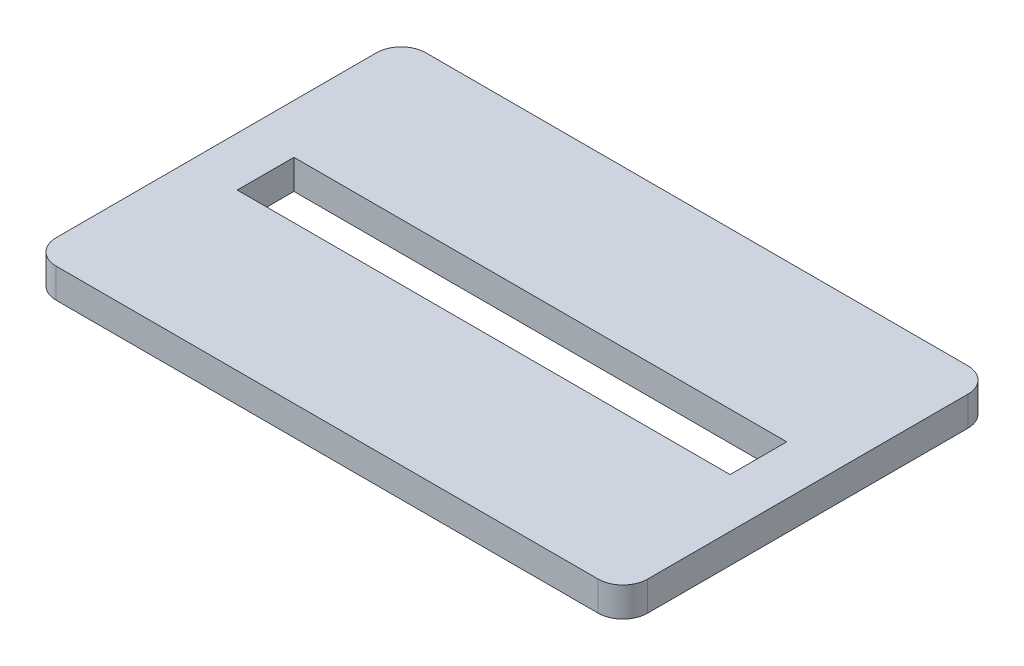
SolidWorks part; units mm, degrees
ref_plane "Front Plane" through (0, 0, 0) normal (0, 0, 1) x (1, 0, 0)
ref_plane "Top Plane" through (0, 0, 0) normal (0, 1, 0) x (1, 0, 0)
ref_plane "Right Plane" through (0, 0, 0) normal (1, 0, 0) x (0, 0, -1)
sketch "Sketch1" plane through (0, 0, 0) normal (0, 1, 0) x (1, 0, 0)
  line L1 (-60, 37.5) -> (60, 37.5)
  line L2 (-60, 37.5) -> (-60, -37.5)
  line L3 (-60, -37.5) -> (60, -37.5)
  line L4 (60, 37.5) -> (60, -37.5)
  line L5 (-60, 37.5) -> (60, -37.5) construction
  line L6 (-60, -37.5) -> (60, 37.5) construction
  line L7 (-50, 5.75) -> (50, 5.75)
  line L8 (-50, 5.75) -> (-50, -5.75)
  line L9 (-50, -5.75) -> (50, -5.75)
  line L10 (50, 5.75) -> (50, -5.75)
  line L11 (-50, 5.75) -> (50, -5.75) construction
  line L12 (-50, -5.75) -> (50, 5.75) construction
  point P0 (0, 0)
  point P6 (0, 0)
  dimension "D1" = 120
  dimension "D2" = 75
  dimension "D3" = 11.5
  dimension "D4" = 100
extrude "Boss-Extrude1" add sketch "Sketch1" along normal blind 6
fillet "Fillet1" radius 5 4 edges at (-60, 3, -37.5) (60, 3, -37.5) (60, 3, 37.5) (-60, 3, 37.5)
